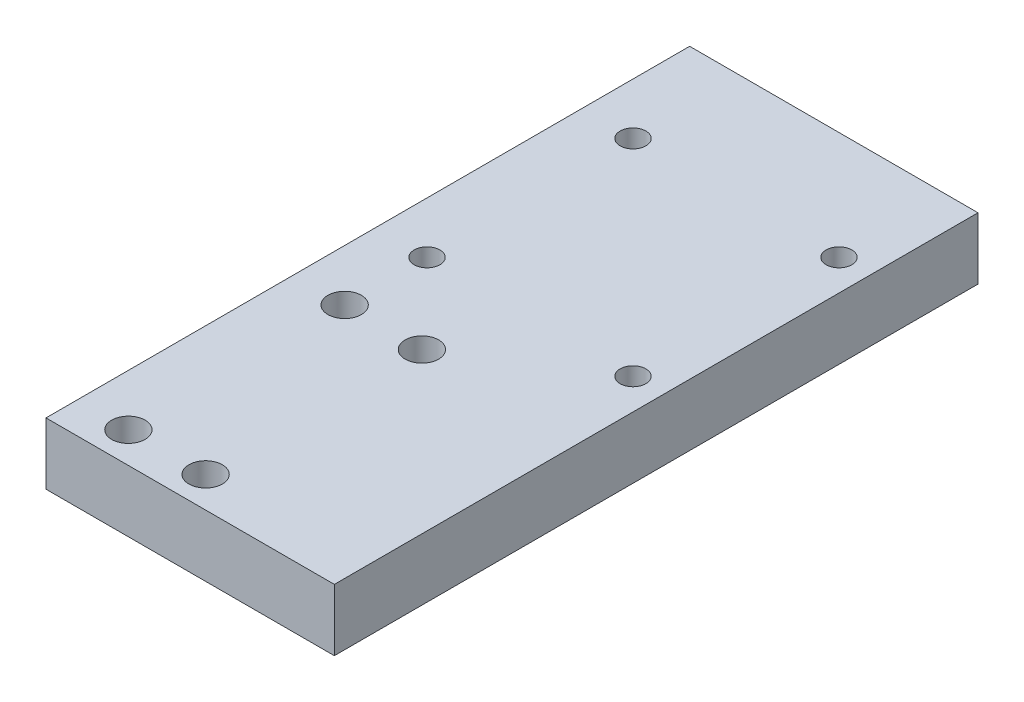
SolidWorks part; units mm, degrees
ref_plane "前视基准面" through (0, 0, 0) normal (0, 0, 1) x (1, 0, 0)
ref_plane "上视基准面" through (0, 0, 0) normal (0, 1, 0) x (1, 0, 0)
ref_plane "右视基准面" through (0, 0, 0) normal (1, 0, 0) x (0, 0, -1)
sketch "草图1" plane through (0, 0, 0) normal (0, 0, 1) x (1, 0, 0)
  line L0 (0, 0) -> (0, 12)
  line L1 (56, 0) -> (56, 12)
  line L2 (0, 12) -> (56, 12)
  line L3 (0, 0) -> (56, 0)
extrude "凸台-拉伸1" add sketch "草图1" along normal blind 125
sketch "草图2" plane through (0, 12, 0) normal (0, 1, 0) x (1, 0, 0)
  circle A0 centre (10, -77) radius 3.25
  circle A1 centre (10, -119) radius 3.25
  circle A2 centre (25, -119) radius 3.25
  circle A3 centre (25, -77) radius 3.25
  circle A4 centre (10, -21) radius 2.5
  circle A5 centre (50, -21) radius 2.5
  circle A6 centre (50, -61) radius 2.5
  circle A7 centre (10, -61) radius 2.5
extrude "切除-拉伸1" cut sketch "草图2" against normal blind 125
sketch "草图3" plane through (0, 12, 0) normal (0, 1, 0) x (1, 0, 0)
  circle A0 centre (10, -77) radius 5.5 construction
  circle A1 centre (10, -119) radius 5.5 construction
  circle A2 centre (25, -119) radius 5.5 construction
  circle A3 centre (25, -77) radius 5.5 construction
sketch "草图4" plane through (0, 0, 0) normal (0, -1, 0) x (1, 0, 0)
  circle A0 centre (10, 119) radius 5.5
  circle A1 centre (25, 119) radius 5.5
  circle A2 centre (25, 77) radius 5.5
  circle A3 centre (10, 77) radius 5.5
extrude "切除-拉伸2" cut sketch "草图4" against normal blind 6.5
sketch "草图5" plane through (0, 0, 125) normal (0, 0, 1) x (1, 0, 0)
  circle A0 centre (6, 6) radius 2.1
  circle A1 centre (24, 6) radius 2.1
sketch "草图6" plane through (0, 0, 0) normal (0, 0, -1) x (-1, 0, 0)
  circle A0 centre (-24, 6) radius 2.1
  circle A1 centre (-6, 6) radius 2.1
extrude "切除-拉伸3" cut sketch "草图6" against normal blind 15
